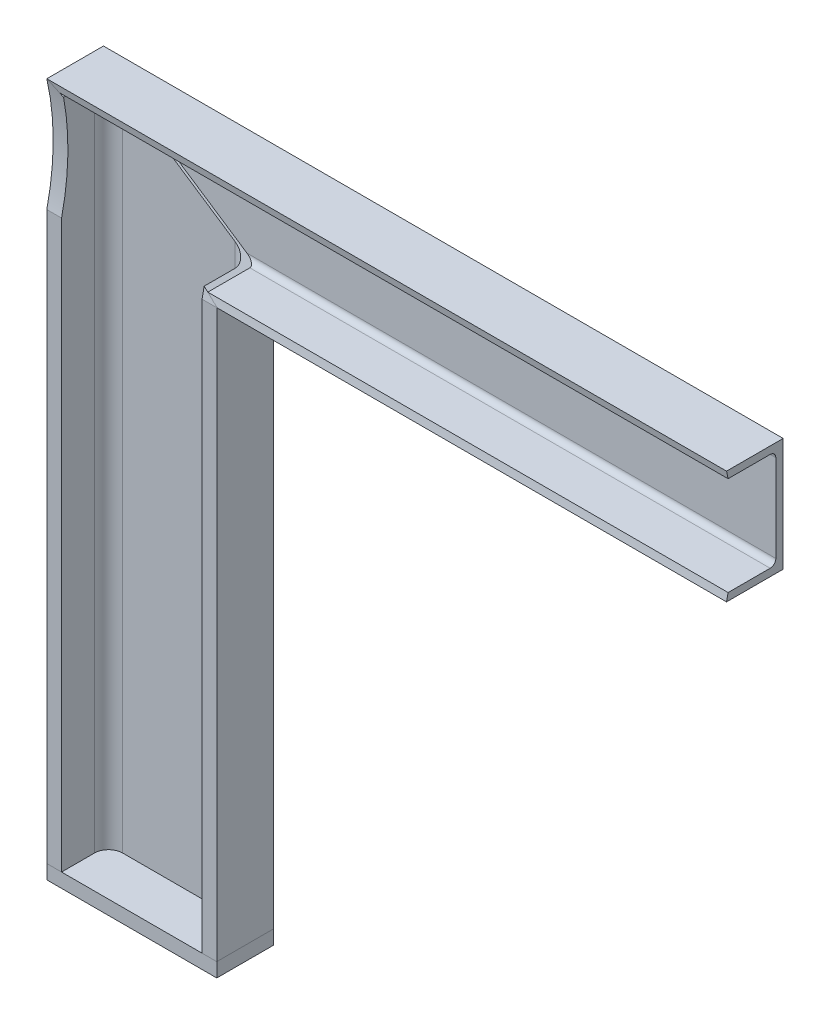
SolidWorks part; units mm, degrees
ref_plane "Front Plane" through (0, 0, 0) normal (0, 0, 1) x (1, 0, 0)
ref_plane "Top Plane" through (0, 0, 0) normal (0, 1, 0) x (1, 0, 0)
ref_plane "Right Plane" through (0, 0, 0) normal (1, 0, 0) x (0, 0, -1)
sketch "Sketch1" plane through (0, 0, 0) normal (0, 0, 1) x (1, 0, 0)
  line L0 (279.709, 31.7479) -> (-25.091, 31.7479)
  line L1 (-25.091, 31.7479) -> (-25.091, -273.0521)
  dimension "D1" = 304.8
  dimension "D2" = 304.8
other "Structural Member1"
ref_plane "Plane1" through (279.709, 31.7479, 0) normal (-1, 0, 0) x (0, -1, 0)
sketch "Sketch12" plane through (279.709, 6.3479, 0) normal (1, 0, 0) x (0, 0, -1)
  line L0 (0, 25.4) -> (0, -25.4)
  line L1 (0, 25.4) -> (25.4, 25.4)
  line L2 (3.302, 19.558) -> (3.302, -19.558)
  line L3 (0, 0) -> (69.2179, 0) construction
  line L4 (5.842, -22.098) -> (25.4, -22.098)
  line L5 (25.4, -25.4) -> (25.4, -22.098)
  line L6 (0, 0) -> (3.302, 0) construction
  line L7 (0, -25.4) -> (25.4, -25.4)
  line L15 (25.4, 25.4) -> (25.4, 22.098)
  line L17 (5.842, 22.098) -> (25.4, 22.098)
  arc A0 (3.302, -19.558) -> (5.842, -22.098) centre (5.842, -19.558) ccw
  arc A10 (3.302, 19.558) -> (5.842, 22.098) centre (5.842, 19.558) cw
  point P4 (25.4, 22.098)
  point P6 (1.651, 0)
  point P7 (12.7, 25.4)
  point P9 (12.7, -25.4)
  point P12 (25.4, -22.098)
  point P16 (0, 0)
  dimension "RI" = 2.54
  dimension "D2" = 25.4
  dimension "flange" = 3.302
  dimension "D1" = 3.302
  dimension "D3" = 25.4
sketch "Sketch27" [suppressed] plane through (0, 0, 0) normal (0, 0, 1) x (1, 0, 0)
  line L0 (-25.091, 31.7479) -> (51.109, -19.0521)
  line L1 (-25.091, -19.0521) -> (279.709, -19.0521) construction
  line L2 (51.109, -19.0521) -> (-25.091, -19.0521)
  line L3 (-25.091, -19.0521) -> (-25.091, 31.7479)
  dimension "D1" = 76.2
extrude "Extrude11" [suppressed] cut sketch "Sketch27" against normal through all
other "Structural Member4"
ref_plane "Plane4" through (-25.091, 31.7479, 0) normal (0, -1, 0) x (1, 0, 0)
sketch "Sketch16" plane through (13.009, 31.7479, 0) normal (0, -1, 0) x (0, 0, -1)
  line L0 (0, 38.1) -> (0, -38.1)
  line L1 (0, 38.1) -> (44.45, 38.1)
  line L2 (4.318, 25.146) -> (4.318, -25.146)
  line L3 (0, 0) -> (69.2179, 0) construction
  line L4 (10.668, -31.496) -> (44.45, -31.496)
  line L5 (44.45, -38.1) -> (44.45, -31.496)
  line L6 (0, 0) -> (4.318, 0) construction
  line L7 (0, -38.1) -> (44.45, -38.1)
  line L15 (44.45, 38.1) -> (44.45, 31.496)
  line L17 (10.668, 31.496) -> (44.45, 31.496)
  arc A0 (4.318, -25.146) -> (10.668, -31.496) centre (10.668, -25.146) ccw
  arc A10 (4.318, 25.146) -> (10.668, 31.496) centre (10.668, 25.146) cw
  point P4 (44.45, 31.496)
  point P6 (2.159, 0)
  point P7 (22.225, 38.1)
  point P9 (22.225, -38.1)
  point P12 (44.45, -31.496)
  point P16 (0, 0)
  dimension "RI" = 6.35
  dimension "D2" = 44.45
  dimension "flange" = 6.604
  dimension "D1" = 4.318
  dimension "D3" = 38.1
other "Structural Member2"
ref_plane "Plane2" through (279.709, 31.7479, 0) normal (-1, 0, 0) x (0, -1, 0)
sketch "Sketch14" plane through (279.709, 6.3479, 0) normal (-1, 0, 0) x (0, 0, 1)
  line L0 (0, 25.4) -> (0, -25.4)
  line L1 (0, 25.4) -> (25.4, 25.4)
  line L2 (3.302, 19.558) -> (3.302, -19.558)
  line L3 (0, 0) -> (69.2179, 0) construction
  line L4 (5.842, -22.098) -> (25.4, -22.098)
  line L5 (25.4, -25.4) -> (25.4, -22.098)
  line L6 (0, 0) -> (3.302, 0) construction
  line L7 (0, -25.4) -> (25.4, -25.4)
  line L15 (25.4, 25.4) -> (25.4, 22.098)
  line L17 (5.842, 22.098) -> (25.4, 22.098)
  arc A0 (3.302, -19.558) -> (5.842, -22.098) centre (5.842, -19.558) ccw
  arc A10 (3.302, 19.558) -> (5.842, 22.098) centre (5.842, 19.558) cw
  point P4 (25.4, 22.098)
  point P6 (1.651, 0)
  point P7 (12.7, 25.4)
  point P9 (12.7, -25.4)
  point P12 (25.4, -22.098)
  point P16 (0, 0)
  dimension "RI" = 2.54
  dimension "D2" = 25.4
  dimension "flange" = 3.302
  dimension "D1" = 3.302
  dimension "D3" = 25.4
sketch "Sketch31" plane through (0, 0, 0) normal (0, 0, -1) x (-1, 0, 0)
  line L0 (25.091, 31.7479) -> (-51.109, -19.0521)
  line L1 (25.091, -19.0521) -> (-279.709, -19.0521) construction
  line L2 (-51.109, -19.0521) -> (25.091, -19.0521)
  line L4 (25.091, -19.0521) -> (25.091, 31.7479)
  dimension "D1" = 76.2
extrude "Extrude15" cut sketch "Sketch31" against normal through all
other "Structural Member5"
ref_plane "Plane5" through (-25.091, 31.7479, 0) normal (0, -1, 0) x (1, 0, 0)
sketch "Sketch17" plane through (13.009, 31.7479, 0) normal (0, -1, 0) x (0, 0, 1)
  line L0 (0, 38.1) -> (0, -38.1)
  line L1 (0, 38.1) -> (44.45, 38.1)
  line L2 (4.318, 25.146) -> (4.318, -25.146)
  line L3 (0, 0) -> (69.2179, 0) construction
  line L4 (10.668, -31.496) -> (44.45, -31.496)
  line L5 (44.45, -38.1) -> (44.45, -31.496)
  line L6 (0, 0) -> (4.318, 0) construction
  line L7 (0, -38.1) -> (44.45, -38.1)
  line L15 (44.45, 38.1) -> (44.45, 31.496)
  line L17 (10.668, 31.496) -> (44.45, 31.496)
  arc A0 (4.318, -25.146) -> (10.668, -31.496) centre (10.668, -25.146) ccw
  arc A10 (4.318, 25.146) -> (10.668, 31.496) centre (10.668, 25.146) cw
  point P4 (44.45, 31.496)
  point P6 (2.159, 0)
  point P7 (22.225, 38.1)
  point P9 (22.225, -38.1)
  point P12 (44.45, -31.496)
  point P16 (0, 0)
  dimension "RI" = 6.35
  dimension "D2" = 44.45
  dimension "flange" = 6.604
  dimension "D1" = 4.318
  dimension "D3" = 38.1
sketch "Sketch37" plane through (0, 31.7479, 0) normal (0, 1, 0) x (1, 0, 0)
  line L1 (51.109, -44.45) -> (-25.091, -44.45)
  line L2 (51.109, -44.45) -> (51.109, -25.4)
  line L3 (51.109, -25.4) -> (-25.091, -25.4)
  line L4 (-25.091, -44.45) -> (-25.091, -25.4)
extrude "Extrude21" cut sketch "Sketch37" against normal through all
sketch "Sketch24" plane through (279.709, 0, 0) normal (1, 0, 0) x (0, 0, -1)
  circle A0 centre (-136.842, 6.3479) radius 114.3
  circle A1 centre (-136.842, 6.3479) radius 114.3 construction
extrude "Extrude8" cut sketch "Sketch24" against normal through all
sketch "Sketch25" [suppressed] plane through (279.709, 0, 0) normal (1, 0, 0) x (0, 0, -1)
  circle A0 centre (136.842, 6.3479) radius 114.3
  circle A1 centre (136.842, 6.3479) radius 114.3 construction
extrude "Extrude9" [suppressed] cut sketch "Sketch25" against normal through all
sketch "Sketch28" [suppressed] plane through (0, 31.7479, 0) normal (0, 1, 0) x (1, 0, 0)
  line L1 (-25.091, 25.4) -> (51.109, 25.4)
  line L2 (-25.091, 25.4) -> (-25.091, 44.45)
  line L3 (-25.091, 44.45) -> (51.109, 44.45)
  line L4 (51.109, 25.4) -> (51.109, 44.45)
extrude "Extrude12" [suppressed] cut sketch "Sketch28" against normal through all
sketch "Sketch30" [suppressed] plane through (0, 0, 0) normal (0, 0, 1) x (1, 0, 0)
  line L0 (-25.091, 31.7479) -> (51.109, 31.7479)
  line L1 (51.109, 31.7479) -> (51.109, -19.0521)
  line L2 (-25.091, -19.0521) -> (279.709, -19.0521) construction
  line L3 (51.109, -273.0521) -> (51.109, 31.7479) construction
  line L4 (51.109, -19.0521) -> (-25.091, 31.7479)
extrude "Extrude13" [suppressed] cut sketch "Sketch30" against normal through all
sketch "Sketch33" plane through (0, 0, 0) normal (0, 0, -1) x (-1, 0, 0)
  line L0 (25.091, 31.7479) -> (-51.109, -18.888)
  line L1 (-51.109, -273.0521) -> (-51.109, 31.7479) construction
  line L2 (-51.109, -18.888) -> (-51.109, 31.7479)
  line L3 (-279.709, 31.7479) -> (25.091, 31.7479) construction
  line L4 (-51.109, 31.7479) -> (25.091, 31.7479)
extrude "Extrude17" cut sketch "Sketch33" against normal through all
sketch "Sketch35" plane through (0, -273.0521, 0) normal (0, -1, 0) x (1, 0, 0)
  line L0 (51.109, 25.4) -> (51.109, 0) construction
  line L1 (-25.091, 0) -> (51.109, 0)
  line L2 (-25.091, 0) -> (-25.091, 25.4)
  line L3 (-25.091, 25.4) -> (51.109, 25.4)
  line L4 (51.109, 0) -> (51.109, 25.4)
  line L5 (51.109, 25.4) -> (279.709, 25.4) construction
extrude "Extrude19" add sketch "Sketch35" along normal blind 6.35 separate body
sketch "Sketch36" [suppressed] plane through (0, -273.0521, 0) normal (0, -1, 0) x (1, 0, 0)
  line L1 (-25.091, 0) -> (51.109, 0)
  line L2 (-25.091, 0) -> (-25.091, -25.4)
  line L3 (-25.091, -25.4) -> (51.109, -25.4)
  line L4 (51.109, 0) -> (51.109, -25.4)
extrude "Extrude20" [suppressed] add sketch "Sketch36" along normal blind 6.35 separate body
